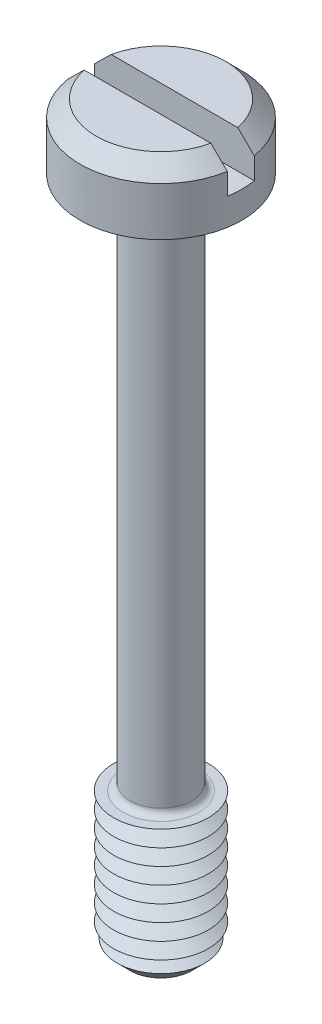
SolidWorks part; units mm, degrees
ref_plane "Front Plane" through (0, 0, 0) normal (0, 0, 1) x (1, 0, 0)
ref_plane "Top Plane" through (0, 0, 0) normal (0, 1, 0) x (1, 0, 0)
ref_plane "Right Plane" through (0, 0, 0) normal (1, 0, 0) x (0, 0, -1)
sketch "Sketch1" plane through (0, 0, 0) normal (0, 1, 0) x (1, 0, 0)
  circle A0 centre (0, 0) radius 3
  dimension "D1" = 6
extrude "Boss-Extrude1" add sketch "Sketch1" along normal blind 2.4
sketch "Sketch2" plane through (0, 0, 0) normal (0, -1, 0) x (1, 0, 0)
  circle A0 centre (0, 0) radius 1.15
  dimension "D1" = 2.3
extrude "Boss-Extrude2" add sketch "Sketch2" along normal blind 25
sketch "Sketch3" plane through (0, -25, 0) normal (0, -1, 0) x (1, 0, 0)
  circle A0 centre (0, 0) radius 1.75
  dimension "D1" = 3.5
extrude "Boss-Extrude3" add sketch "Sketch3" against normal blind 5.2
chamfer "Chamfer1" distance 0.6 angle 45 1 edges at (0, -25, -1.75)
sketch "Sketch4" plane through (0, 0, 0) normal (1, 0, 0) x (0, 0, -1)
  line L0 (0, -6.5871) -> (0, -12.0372) construction
sketch "Sketch5" plane through (0, 0, 0) normal (1, 0, 0) x (0, 0, -1)
  line L0 (-1.75, -19.8) -> (-1.2304, -20.1)
  line L1 (-1.2304, -20.1) -> (-1.75, -20.4)
  line L2 (-1.75, -19.8) -> (-1.75, -24.4) construction
  line L3 (-1.75, -20.4) -> (-1.75, -19.8)
  dimension "D1" = 0.6
revolve "Cut-Revolve1" cut sketch "Sketch5" angle 360 about L0
pattern_linear "LPattern1" count 8 spacing 0.6 along (0, -1, 0) of "Cut-Revolve1"
fillet "Fillet1" radius 0.25 2 edges at (0, -19.8, -1.15) (0, 0, -1.15)
chamfer "Chamfer2" distance 0.6 angle 45 1 edges at (0, 2.4, 3)
sketch "Sketch6" plane through (0, 2.4, 0) normal (0, 1, 0) x (1, 0, 0)
  line L1 (3, -0.5) -> (-3, -0.5)
  line L2 (3, -0.5) -> (3, 0.5)
  line L3 (3, 0.5) -> (-3, 0.5)
  line L4 (-3, -0.5) -> (-3, 0.5)
  line L5 (3, -0.5) -> (-3, 0.5) construction
  line L6 (3, 0.5) -> (-3, -0.5) construction
  circle A0 centre (0, 0) radius 3 construction
  point P0 (0, 0)
  dimension "D1" = 1
extrude "Cut-Extrude1" cut sketch "Sketch6" against normal blind 1.4
